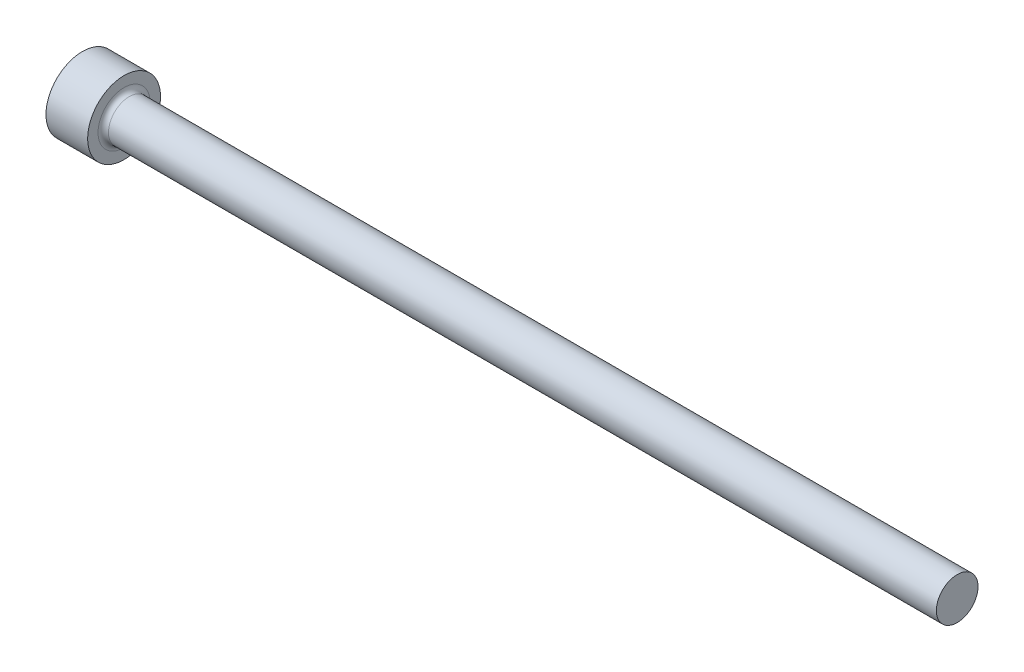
SolidWorks part; units mm, degrees
ref_plane "Plane1" through (0, 0, 0) normal (0, 0, 1) x (1, 0, 0)
ref_plane "Plane2" through (0, 0, 0) normal (0, 1, 0) x (1, 0, 0)
ref_plane "Plane3" through (0, 0, 0) normal (1, 0, 0) x (0, 0, -1)
sketch "Sketch1" plane through (0, 0, 0) normal (0, 0, 1) x (1, 0, 0)
  line L0 (-6.35, 0) -> (-6.35, 5.5562)
  line L1 (-6.35, 5.5562) -> (0, 5.5562)
  line L2 (0, 5.5562) -> (0, 3.9687)
  line L3 (0.7938, 3.175) -> (127, 3.175)
  line L4 (127, 3.175) -> (127, 0)
  line L5 (127, 0) -> (-6.35, 0)
  line L6 (127, 0) -> (-6.35, 0) construction
  arc A0 (0, 3.9687) -> (0.7938, 3.175) centre (0.7938, 3.9687) ccw
revolve "Base-Revolve" add sketch "Sketch1" angle 360 about L6
equation "\"D2@Sketch1\" = \"HeadHeight@Sketch1\""
